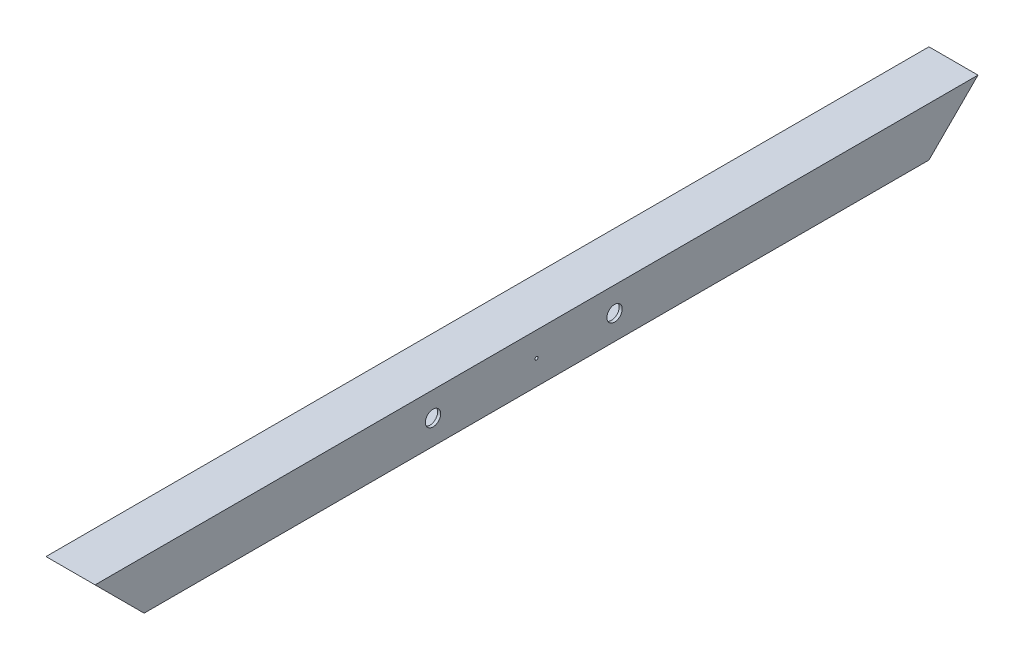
SolidWorks part; units mm, degrees
ref_plane "Front Plane" through (0, 0, 0) normal (0, 0, 1) x (1, 0, 0)
ref_plane "Top Plane" through (0, 0, 0) normal (0, 1, 0) x (1, 0, 0)
ref_plane "Right Plane" through (0, 0, 0) normal (1, 0, 0) x (0, 0, -1)
sketch "Sketch1" plane through (0, 0, 0) normal (0, 0, 1) x (1, 0, 0)
  line L0 (-22.225, -22.225) -> (-22.225, 22.225)
  line L1 (-25.4, -25.4) -> (25.4, -25.4)
  line L2 (-25.4, -25.4) -> (-25.4, 25.4)
  line L3 (-25.4, 25.4) -> (25.4, 25.4)
  line L4 (25.4, -25.4) -> (25.4, 25.4)
  line L5 (-22.225, 22.225) -> (22.225, 22.225)
  line L6 (22.225, -22.225) -> (22.225, 22.225)
  line L7 (-22.225, -22.225) -> (22.225, -22.225)
  dimension "D1" = 50.8
  dimension "D2" = 50.8
  dimension "D3" = 25.4
  dimension "D4" = 25.4
  dimension "D5" = 3.175
extrude "Boss-Extrude1" add sketch "Sketch1" against normal blind 914.4
sketch "Sketch2" plane through (-25.4, 0, 0) normal (-1, 0, 0) x (0, 0, 1)
  line L0 (-914.4, 25.4) -> (-863.6, -25.4)
  line L1 (-914.4, -25.4) -> (0, -25.4) construction
  line L2 (-914.4, 25.4) -> (-914.4, -25.4) construction
  dimension "D1" = 45
extrude "Cut-Extrude1" cut sketch "Sketch2" against normal through all and the other way through all flip side to cut
sketch "Sketch3" plane through (-25.4, 0, 0) normal (-1, 0, 0) x (0, 0, 1)
  line L0 (0, 25.4) -> (-50.8, -25.4)
  line L1 (-863.6, -25.4) -> (0, -25.4) construction
  line L2 (0, 25.4) -> (0, -25.4) construction
  dimension "D1" = 45
extrude "Cut-Extrude2" cut sketch "Sketch3" against normal through all and the other way through all
sketch "Sketch4" plane through (-25.4, 0, 0) normal (-1, 0, 0) x (0, 0, 1)
  line L1 (-914.4, 25.4) -> (0, 25.4) construction
  circle A0 centre (-538.0228, 0) radius 7.9375
  circle A1 centre (-350.012, 0) radius 7.9375
  point P8 (-457.2, 25.4)
  dimension "D3" = 15.875
  dimension "D4" = 15.875
  dimension "D1" = 188.0108
  dimension "D2" = 80.8228
extrude "Cut-Extrude3" cut sketch "Sketch4" against normal through all
sketch "Sketch5" plane through (-25.4, 0, 0) normal (-1, 0, 0) x (0, 0, 1)
  circle A0 centre (-457.2, 0) radius 1.5875
  dimension "D1" = 3.175
  dimension "D2" = 457.2
extrude "Cut-Extrude4" cut sketch "Sketch5" against normal through all
